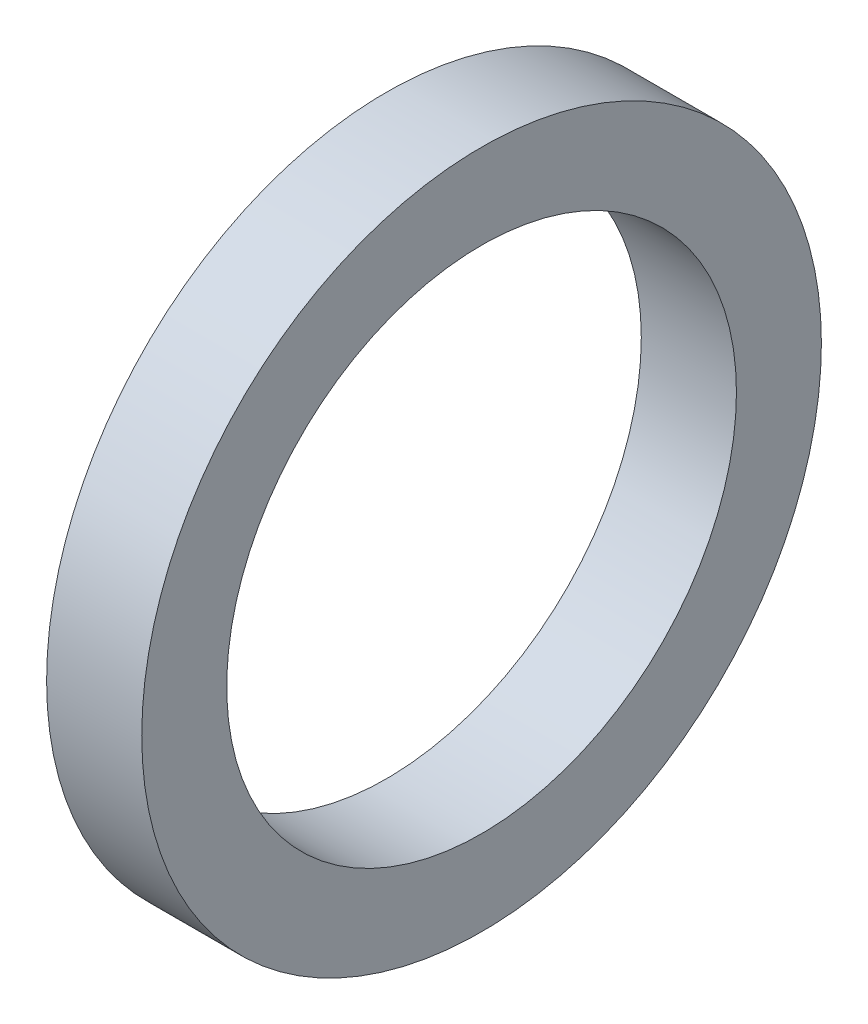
SolidWorks part; units mm, degrees
ref_plane "Front Plane" through (0, 0, 0) normal (0, 0, 1) x (1, 0, 0)
ref_plane "Top Plane" through (0, 0, 0) normal (0, 1, 0) x (1, 0, 0)
ref_plane "Right Plane" through (0, 0, 0) normal (1, 0, 0) x (0, 0, -1)
sketch "Sketch1" plane through (0, 0, 0) normal (1, 0, 0) x (0, 0, -1)
  circle A0 centre (0, 0) radius 7.5
  circle A1 centre (0, 0) radius 10
  dimension "D1" = 20
  dimension "D2" = 15
extrude "Boss-Extrude1" add sketch "Sketch1" along normal blind 2.8
